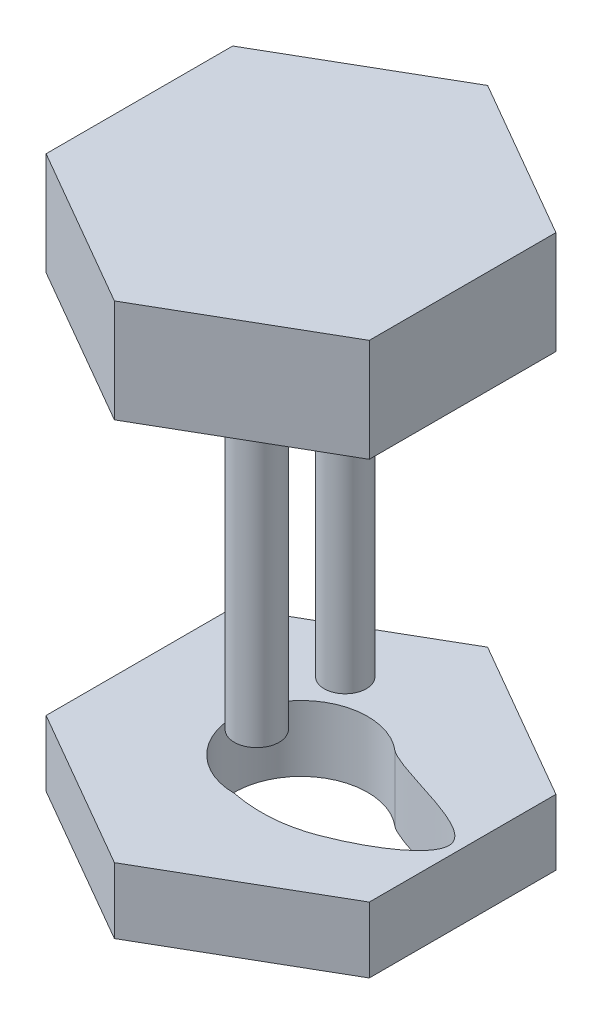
SolidWorks part; units mm, degrees
ref_plane "Front Plane" through (0, 0, 0) normal (0, 0, 1) x (1, 0, 0)
ref_plane "Top Plane" through (0, 0, 0) normal (0, 1, 0) x (1, 0, 0)
ref_plane "Right Plane" through (0, 0, 0) normal (1, 0, 0) x (0, 0, -1)
sketch "Sketch1" plane through (0, 0, 0) normal (0, 1, 0) x (1, 0, 0)
  circle A0 centre (0, 0) radius 11.5282
extrude "Boss-Extrude1" add sketch "Sketch1" along normal blind 2.54
sketch "Sketch2" plane through (0, 2.54, 0) normal (0, 1, 0) x (-1, 0, 0)
  line L0 (0, 0) -> (0, -11.5282)
  line L1 (0, -11.5282) -> (0, 11.5282)
  line L2 (5.1804, 5.1805) -> (-5.1804, 5.1805)
  line L3 (-11.5282, 0) -> (11.5282, 0)
  line L4 (5.1804, 5.1805) -> (5.1804, -5.1805)
  line L5 (-5.1804, 5.1805) -> (-5.1804, -5.1805)
  line L6 (5.1804, -5.1805) -> (-5.1804, -5.1805)
  line L7 (5.1804, 5.1805) -> (-5.1804, -5.1805) construction
  line L8 (-5.1804, 5.1805) -> (5.1804, -5.1805) construction
  circle A0 centre (0, 0) radius 11.5282 construction
  circle A1 centre (5.1804, 0) radius 2.5501
  circle A2 centre (-5.1804, 0) radius 2.5993
sketch "Sketch4" plane through (0, 2.54, 0) normal (0, 1, 0) x (1, 0, 0)
  line L1 (0, 21.624) -> (-18.7269, 10.812)
  line L2 (-18.7269, 10.812) -> (-18.7269, -10.812)
  line L3 (-18.7269, -10.812) -> (0, -21.624)
  line L4 (0, -21.624) -> (18.7269, -10.812)
  line L5 (18.7269, -10.812) -> (18.7269, 10.812)
  line L6 (18.7269, 10.812) -> (0, 21.624)
  circle A0 centre (0, 0) radius 18.7269 construction
extrude "Boss-Extrude6" add sketch "Sketch4" along normal blind 11.938
sketch "Sketch6" plane through (0, 0, 0) normal (0, -1, 0) x (1, 0, 0)
  circle A0 centre (0, 0) radius 11.5282
extrude "Cut-Extrude4" cut sketch "Sketch6" against normal blind 6.604
sketch "Sketch7" plane through (0, 6.604, 0) normal (0, -1, 0) x (1, 0, 0)
  line L4 (18.7269, 10.812) -> (18.7269, -10.812) construction
  line L5 (18.7269, 0) -> (18.7269, 10.812)
  circle A0 centre (5.1277, 0) radius 2.437
  circle A1 centre (-5.1277, 0) radius 2.5983
  point P17 (0, 0)
extrude "Boss-Extrude7" add sketch "Sketch7" along normal blind 38.0828 contours A0 | A1
sketch "Sketch8" plane through (0, -31.4788, 0) normal (0, -1, 0) x (1, 0, 0)
  circle A0 centre (-5.1277, 0) radius 2.5983
extrude "Boss-Extrude8" add sketch "Sketch8" along normal blind 10.414
sketch "Sketch9" plane through (0, 6.604, 0) normal (0, -1, 0) x (1, 0, 0)
  line L0 (0, 21.624) -> (0, -21.624)
  line L1 (0, -21.624) -> (18.7269, 0)
  line L2 (18.7269, 10.812) -> (18.7269, -10.812) construction
  line L3 (18.7269, 0) -> (-18.7269, 0)
  line L4 (-18.7269, -10.812) -> (-18.7269, 10.812) construction
sketch "Sketch11" plane through (0, -41.8928, 0) normal (0, -1, 0) x (1, 0, 0)
  line L0 (18.7269, 0) -> (-18.7269, 0) construction
  line L1 (0, 21.624) -> (-18.7269, 10.812)
  line L2 (-18.7269, 10.812) -> (-18.7269, -10.812)
  line L3 (-18.7269, -10.812) -> (0, -21.624)
  line L4 (0, -21.624) -> (18.7269, -10.812)
  line L5 (18.7269, -10.812) -> (18.7269, 10.812)
  line L6 (18.7269, 10.812) -> (0, 21.624)
  arc A0 (0, 7.726) -> (5.0928, -5.8098) centre (0, 0) ccw
  circle A1 centre (0, 0) radius 18.7269 construction
  circle A2 centre (0, 0) radius 11.5282 construction
  spline S0 degree 3 poles (9.1358, 7.0311) (9.1358, 7.0311) (13.8393, 5.2322) (24.2679, -1.7658) (6.4794, -4.2641) (4.6906, -6.1392) knots 0.266038 0.266038 0.266038 0.266038 0.266038 0.584975 1 1 1 1
  spline S1 degree 2 poles (0, 7.726) (4.857, 8.6676) (9.1358, 7.0311) knots 0 0 0 1 1 1
extrude "Boss-Extrude9" add sketch "Sketch11" along normal blind 7.62 separate body contours L5 L6 L1 L2 L3 L4 A0 S1 S0
